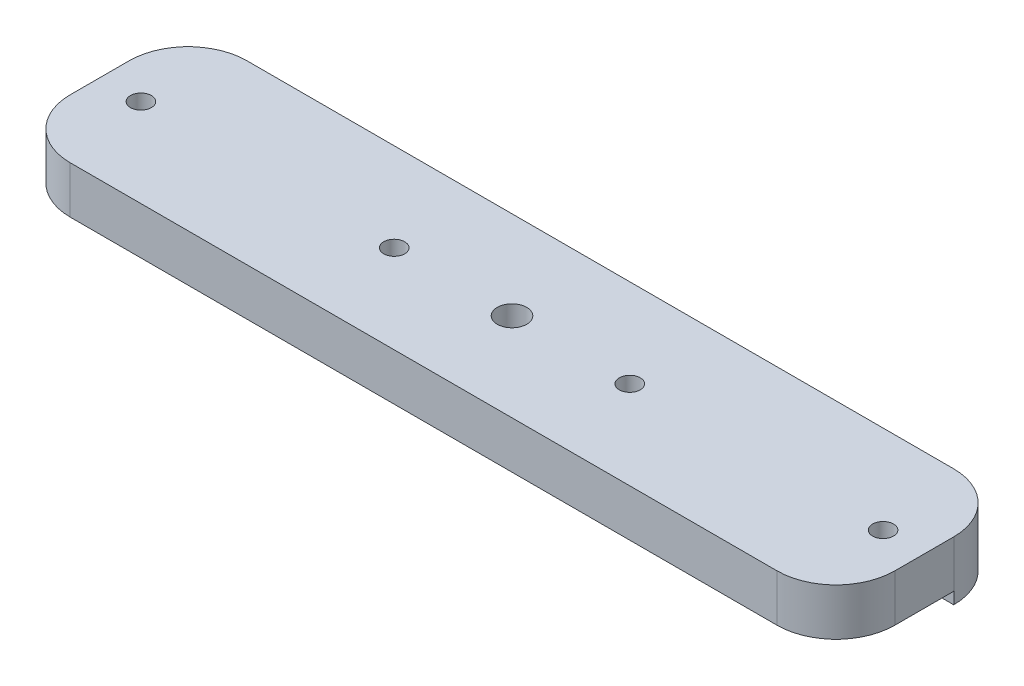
SolidWorks part; units mm, degrees
ref_plane "Front Plane" through (0, 0, 0) normal (0, 0, 1) x (1, 0, 0)
ref_plane "Top Plane" through (0, 0, 0) normal (0, 1, 0) x (1, 0, 0)
ref_plane "Right Plane" through (0, 0, 0) normal (1, 0, 0) x (0, 0, -1)
sketch "Sketch1" plane through (0, 0, 0) normal (0, 1, 0) x (1, 0, 0)
  line L1 (-44.45, -9.525) -> (44.45, -9.525)
  line L2 (-44.45, -9.525) -> (-44.45, 9.525)
  line L3 (-44.45, 9.525) -> (44.45, 9.525)
  line L4 (44.45, -9.525) -> (44.45, 9.525)
  line L5 (-44.45, -9.525) -> (44.45, 9.525) construction
  line L6 (-44.45, 9.525) -> (44.45, -9.525) construction
  point P0 (0, 0)
  dimension "D1" = 88.9
  dimension "D2" = 19.05
extrude "Extrude1" add sketch "Sketch1" along normal blind 6.35
sketch "Sketch2" plane through (0, 6.35, 0) normal (0, 1, 0) x (-1, 0, 0)
  point P0 (0, 0)
hole_wizard "#4-40 Tapped Hole1" positions "3DSketch1" profile "Sketch3" tap size "#4-40" standard "Ansi Inch"
sketch3d "3DSketch1"
  line L3 (-44.45, 6.35, 0) -> (44.45, 6.35, 0) construction
  line L4 (-44.45, 6.35, -9.525) -> (-44.45, 6.35, 9.525) construction
  line L5 (44.45, 6.35, 9.525) -> (44.45, 6.35, -9.525) construction
  point P6 (2.54, 6.35, 0)
  dimension "D3" = 2.54
sketch "Sketch3" plane through (2.54, 6.35, 0) normal (1, 0, 0) x (0, 0, 1)
  line L0 (0, 0) -> (0, 6.35)
  line L1 (0, 6.35) -> (1.1303, 6.35)
  line L2 (1.1303, 6.35) -> (1.1303, 0)
  line L5 (1.1303, 0) -> (0, 0)
  line L11 (0, -6.35) -> (0, 107.95) construction
  dimension "Thru Tap Drill Dia." = 2.2606
  dimension "Thru Tap Drill Depth" = 6.35
sketch "Sketch4" plane through (0, 6.35, 0) normal (0, 1, 0) x (-1, 0, 0)
  line L0 (44.45, -9.525) -> (44.45, 9.525) construction
  line L1 (-44.45, 9.525) -> (-44.45, -9.525) construction
  line L2 (40.005, 0) -> (-40.005, 0)
  point P0 (40.005, 0)
  point P1 (-40.005, 0)
  point P2 (44.45, 0)
  point P11 (0, 0)
  point P12 (12.7, 0)
  point P13 (-12.7, 0)
  dimension "D1" = 4.445
  dimension "D2" = 4.445
  dimension "D3" = 12.7
  dimension "D4" = 12.7
hole_wizard "#4-40 Tapped Hole2" positions "3DSketch2" profile "Sketch5" tap size "#4-40" standard "Ansi Inch"
sketch3d "3DSketch2"
  point P0 (-40.005, 6.35, 0)
  point P3 (40.005, 6.35, 0)
  point P6 (-12.7, 6.35, 0)
  point P12 (12.7, 6.35, 0)
sketch "Sketch5" plane through (-40.005, 6.35, 0) normal (1, 0, 0) x (0, 0, 1)
  line L0 (0, 0) -> (0, 8.2992)
  line L1 (0, 8.2992) -> (1.1303, 7.62)
  line L2 (1.1303, 7.62) -> (1.1303, 0)
  line L5 (1.1303, 0) -> (0, 0)
  line L10 (0, 8.2992) -> (-1.1303, 7.62) construction
  line L11 (0, -6.35) -> (0, 107.95) construction
  dimension "Tap Drill Dia." = 2.2606
  dimension "Tap Drill Depth" = 7.62
  dimension "Drill Angle" = 118
fillet "Fillet1" radius 6.35 4 edges at (-44.45, 3.175, -9.525) (44.45, 3.175, -9.525) (44.45, 3.175, 9.525) (-44.45, 3.175, 9.525)
sketch "Sketch8" plane through (0, 0, 0) normal (0, -1, 0) x (1, 0, 0)
  line L0 (-44.45, -3.175) -> (44.45, -3.175)
  line L1 (44.45, 3.175) -> (44.45, -3.175) construction
  line L2 (-38.1, 9.525) -> (38.1, 9.525) construction
  line L3 (-44.45, -3.175) -> (-44.45, 3.175) construction
  line L4 (44.45, 3.175) -> (44.45, -3.175)
  line L5 (-38.1, 9.525) -> (38.1, 9.525)
  line L6 (-44.45, -3.175) -> (-44.45, 3.175)
  arc A0 (44.45, 3.175) -> (38.1, 9.525) centre (38.1, 3.175) ccw construction
  arc A1 (-38.1, 9.525) -> (-44.45, 3.175) centre (-38.1, 3.175) ccw construction
  arc A2 (44.45, 3.175) -> (38.1, 9.525) centre (38.1, 3.175) ccw
  arc A3 (-38.1, 9.525) -> (-44.45, 3.175) centre (-38.1, 3.175) ccw
extrude "Extrude3" cut sketch "Sketch8" against normal blind 1.27
hole_wizard "#4 Clearance Hole1" positions "Sketch10" profile "Sketch9" hole size "#4" standard "Ansi Inch"
sketch "Sketch10" plane through (0, 6.35, 0) normal (0, 1, 0) x (-1, 0, 0)
  point P1 (0, 0)
sketch "Sketch9" plane through (0, 6.35, 0) normal (1, 0, 0) x (0, 0, 1)
  line L0 (0, 0) -> (0, 10.3519)
  line L1 (0, 10.3519) -> (1.5875, 9.398)
  line L2 (1.5875, 9.398) -> (1.5875, 0)
  line L5 (1.5875, 0) -> (0, 0)
  line L10 (0, 10.3519) -> (-1.5875, 9.398) construction
  line L11 (0, -6.35) -> (0, 107.95) construction
  dimension "Hole Dia." = 3.175
  dimension "Hole Depth" = 9.398
  dimension "Drill Angle" = 118
